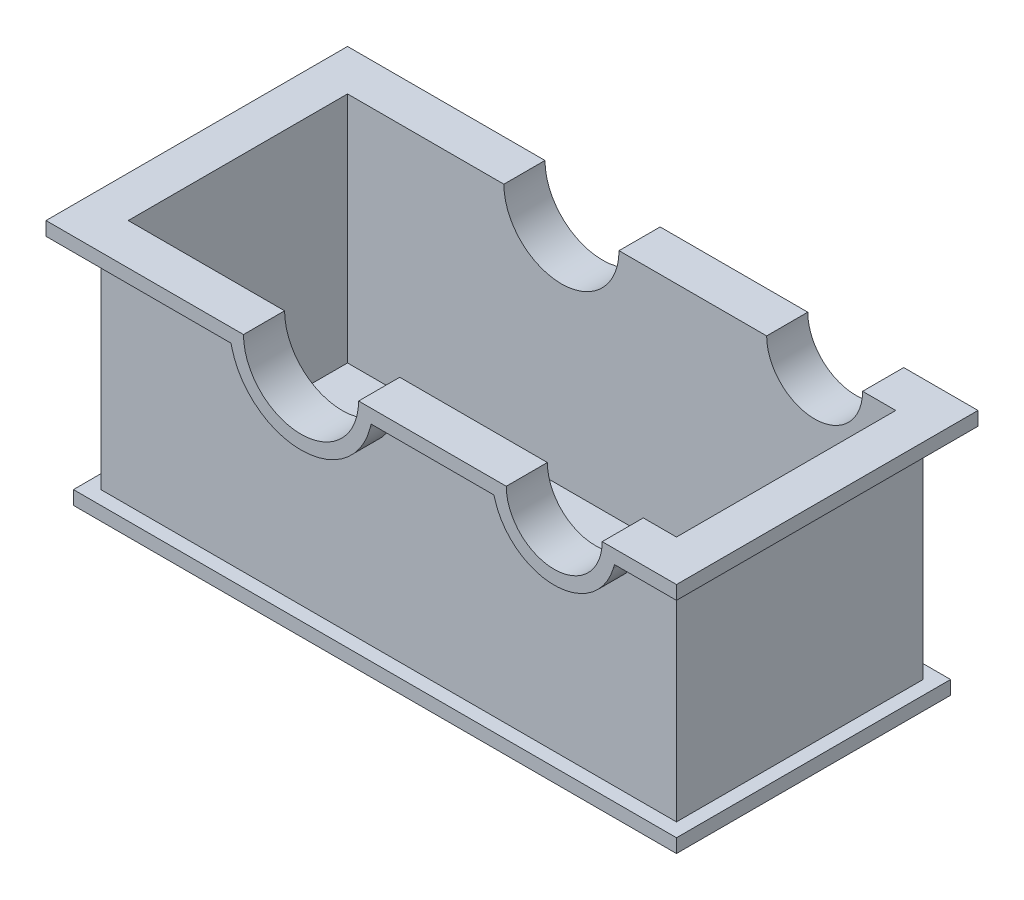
SolidWorks part; units mm, degrees
ref_plane "Front Plane" through (0, 0, 0) normal (0, 0, 1) x (1, 0, 0)
ref_plane "Top Plane" through (0, 0, 0) normal (0, 1, 0) x (1, 0, 0)
ref_plane "Right Plane" through (0, 0, 0) normal (1, 0, 0) x (0, 0, -1)
sketch "Sketch1" plane through (0, 0, 0) normal (0, 1, 0) x (1, 0, 0)
  line L1 (0, 0) -> (210, 0)
  line L2 (0, 0) -> (0, 90)
  line L3 (0, 90) -> (210, 90)
  line L4 (210, 0) -> (210, 90)
  line L5 (105, 90) -> (105, 0) construction
  line L6 (0, 45) -> (210, 45) construction
  line L10 (5, 5) -> (205, 5)
  line L11 (205, 5) -> (205, 85)
  line L12 (5, 85) -> (205, 85)
  line L13 (5, 5) -> (5, 85)
  line L14 (-5, 95) -> (215, 95)
  line L15 (215, -5) -> (215, 95)
  line L16 (-5, -5) -> (215, -5)
  line L17 (-5, -5) -> (-5, 95)
  point P428 (105, 45)
  dimension "D1" = 90
  dimension "D2" = 210
  dimension "D3" = 5
  dimension "D4" = 5
extrude "Boss-Extrude2" add sketch "Sketch1" along normal blind 5 contours L17 L14 L15 L16
sketch "Sketch3" plane through (0, 5, 0) normal (0, 1, 0) x (1, 0, 0)
  line L0 (205, 5) -> (205, 85) construction
  line L1 (210, 0) -> (210, 90) construction
  line L2 (5, 5) -> (205, 5) construction
  line L3 (0, 0) -> (210, 0) construction
  line L4 (0, 90) -> (210, 90) construction
  line L5 (0, 0) -> (0, 90) construction
  line L6 (5, 5) -> (5, 85) construction
  line L7 (5, 85) -> (205, 85) construction
  line L8 (205, 5) -> (205, 85)
  line L9 (210, 0) -> (210, 90)
  line L10 (5, 5) -> (205, 5)
  line L11 (0, 0) -> (210, 0)
  line L12 (0, 90) -> (210, 90)
  line L13 (0, 0) -> (0, 90)
  line L14 (5, 5) -> (5, 85)
  line L15 (5, 85) -> (205, 85)
extrude "Boss-Extrude3" add sketch "Sketch3" along normal blind 80
sketch "Sketch4" plane through (0, 85, 0) normal (0, 1, 0) x (1, 0, 0)
  line L0 (220, -10) -> (220, 100)
  line L1 (-10, 100) -> (220, 100)
  line L2 (-10, -10) -> (-10, 100)
  line L3 (-10, -10) -> (220, -10)
  line L8 (205, 5) -> (205, 85) construction
  line L9 (5, 5) -> (205, 5) construction
  line L10 (5, 5) -> (5, 85) construction
  line L11 (5, 85) -> (205, 85) construction
  line L12 (205, 5) -> (205, 85)
  line L13 (5, 5) -> (205, 5)
  line L14 (5, 5) -> (5, 85)
  line L15 (5, 85) -> (205, 85)
  dimension "D1" = 15
extrude "Boss-Extrude4" add sketch "Sketch4" along normal blind 5
sketch "Sketch5" plane through (0, 0, 10) normal (0, 0, 1) x (1, 0, 0)
  line L0 (-10, 90) -> (220, 90) construction
  circle A0 centre (83.0394, 90) radius 21
  circle A1 centre (175.3994, 90) radius 17.5
  circle A2 centre (83.0394, 90) radius 69.27 construction
  circle A3 centre (175.3994, 90) radius 23.09 construction
  dimension "D1" = 42
  dimension "D2" = 35
  dimension "D3" = 138.54
  dimension "D4" = 46.18
extrude "Cut-Extrude1" cut sketch "Sketch5" against normal through all
sketch "Sketch6" plane through (0, 0, 0) normal (0, 0, 1) x (1, 0, 0)
  line L0 (57.7871, 83.8095) -> (57.4952, 85)
  line L1 (0, 85) -> (62.6433, 85) construction
  line L2 (108.2917, 83.8095) -> (108.5835, 85)
  line L3 (103.4354, 85) -> (158.6289, 85) construction
  line L4 (57.4952, 85) -> (62.6433, 85)
  line L5 (108.5835, 85) -> (103.4354, 85)
  line L6 (153.8373, 83.5714) -> (153.4114, 85)
  line L7 (103.4354, 85) -> (158.6289, 85) construction
  line L8 (196.9614, 83.5714) -> (197.3874, 85)
  line L9 (192.1699, 85) -> (210, 85) construction
  line L10 (197.3874, 85) -> (192.1699, 85)
  line L11 (158.6289, 85) -> (153.4114, 85)
  arc A0 (62.6433, 85) -> (103.4354, 85) centre (83.0394, 90) ccw construction
  arc A1 (158.6289, 85) -> (192.1699, 85) centre (175.3994, 90) ccw construction
  arc A2 (62.6433, 85) -> (103.4354, 85) centre (83.0394, 90) ccw
  arc A3 (158.6289, 85) -> (192.1699, 85) centre (175.3994, 90) ccw
  arc A4 (57.7871, 83.8095) -> (108.2917, 83.8095) centre (83.0394, 90) ccw
  arc A5 (153.8373, 83.5714) -> (196.9614, 83.5714) centre (175.3994, 90) ccw
  dimension "D1" = 5
extrude "Boss-Extrude6" add sketch "Sketch6" along normal blind 10
sketch "Sketch8" plane through (0, 0, -90) normal (0, 0, -1) x (-1, 0, 0)
  line L0 (-196.9614, 83.5714) -> (-197.3874, 85) construction
  line L1 (-153.8373, 83.5714) -> (-153.4114, 85) construction
  line L2 (-158.6289, 85) -> (-153.4114, 85) construction
  line L3 (-197.3874, 85) -> (-192.1699, 85) construction
  line L4 (-57.7871, 83.8095) -> (-57.4952, 85) construction
  line L5 (-57.4952, 85) -> (-62.6433, 85) construction
  line L6 (-108.2917, 83.8095) -> (-108.5835, 85) construction
  line L7 (-108.5835, 85) -> (-103.4354, 85) construction
  line L8 (-108.5835, 85) -> (-103.4354, 85)
  line L9 (-108.2917, 83.8095) -> (-108.5835, 85)
  line L10 (-57.4952, 85) -> (-62.6433, 85)
  line L11 (-57.7871, 83.8095) -> (-57.4952, 85)
  line L12 (-196.9614, 83.5714) -> (-197.3874, 85)
  line L13 (-197.3874, 85) -> (-192.1699, 85)
  line L14 (-158.6289, 85) -> (-153.4114, 85)
  line L15 (-153.8373, 83.5714) -> (-153.4114, 85)
  arc A0 (-196.9614, 83.5714) -> (-153.8373, 83.5714) centre (-175.3994, 90) ccw construction
  arc A1 (-192.1699, 85) -> (-158.6289, 85) centre (-175.3994, 90) ccw construction
  arc A2 (-108.2917, 83.8095) -> (-57.7871, 83.8095) centre (-83.0394, 90) ccw construction
  arc A3 (-103.4354, 85) -> (-62.6433, 85) centre (-83.0394, 90) ccw construction
  arc A4 (-103.4354, 85) -> (-62.6433, 85) centre (-83.0394, 90) ccw
  arc A5 (-108.2917, 83.8095) -> (-57.7871, 83.8095) centre (-83.0394, 90) ccw
  arc A6 (-192.1699, 85) -> (-158.6289, 85) centre (-175.3994, 90) ccw
  arc A7 (-196.9614, 83.5714) -> (-153.8373, 83.5714) centre (-175.3994, 90) ccw
extrude "Boss-Extrude7" add sketch "Sketch8" along normal blind 10
